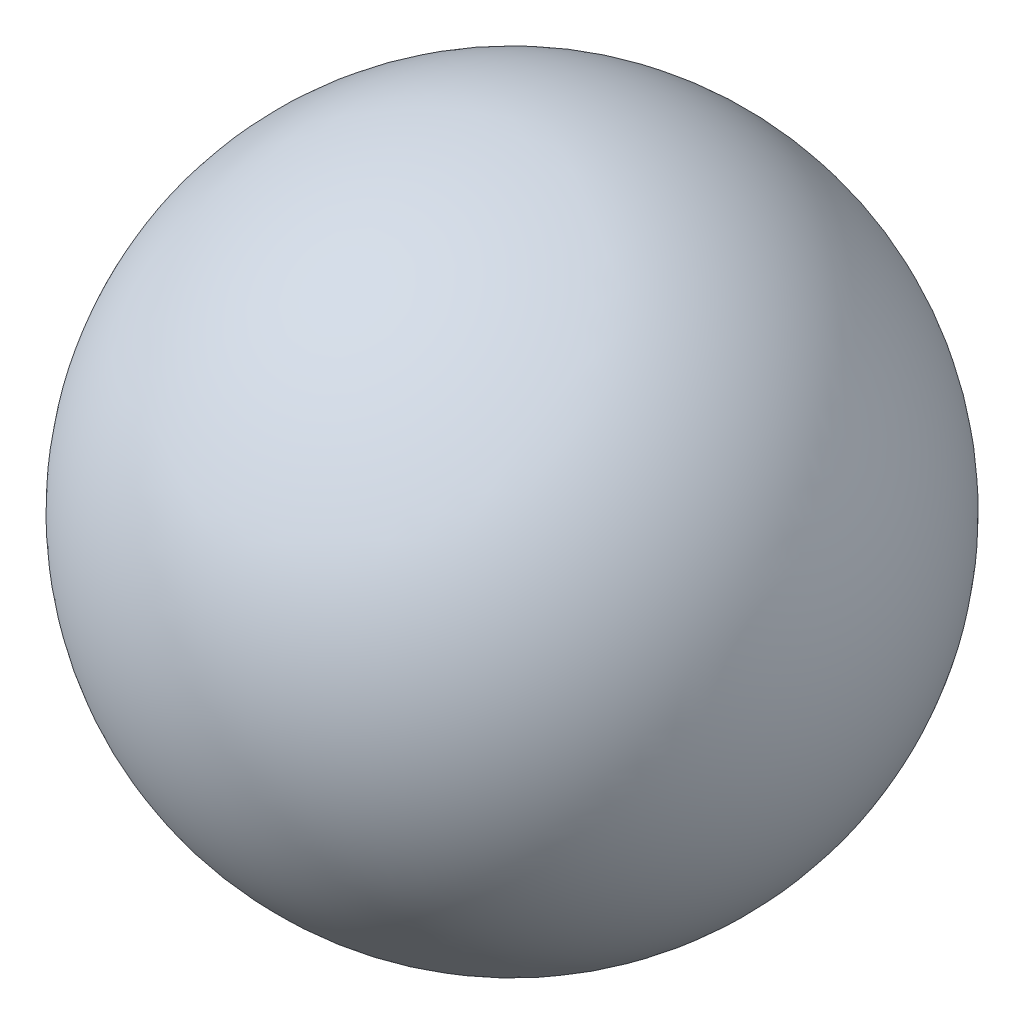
SolidWorks part; units mm, degrees
ref_plane "Plan1" through (0, 0, 0) normal (0, 0, 1) x (1, 0, 0)
ref_plane "Plan2" through (0, 0, 0) normal (0, 1, 0) x (1, 0, 0)
ref_plane "Plan3" through (0, 0, 0) normal (1, 0, 0) x (0, 0, -1)
sketch "Esquisse1" plane through (0, 0, 0) normal (0, 1, 0) x (1, 0, 0)
  line L1 (-0.3, 3.45) -> (6.7, 3.45) construction
  line L2 (-0.3, 6.9) -> (-0.3, 0) construction
  line L3 (6.7, 6.9) -> (6.7, 0) construction
  line L4 (0.95, 3.45) -> (5.45, 3.45)
  circle A1 centre (3.2, 3.45) radius 2.25 construction
  arc A2 (5.45, 3.45) -> (0.95, 3.45) centre (3.2, 3.45) ccw
revolve "Base-Révolution" add sketch "Esquisse1" angle 360 about L1
